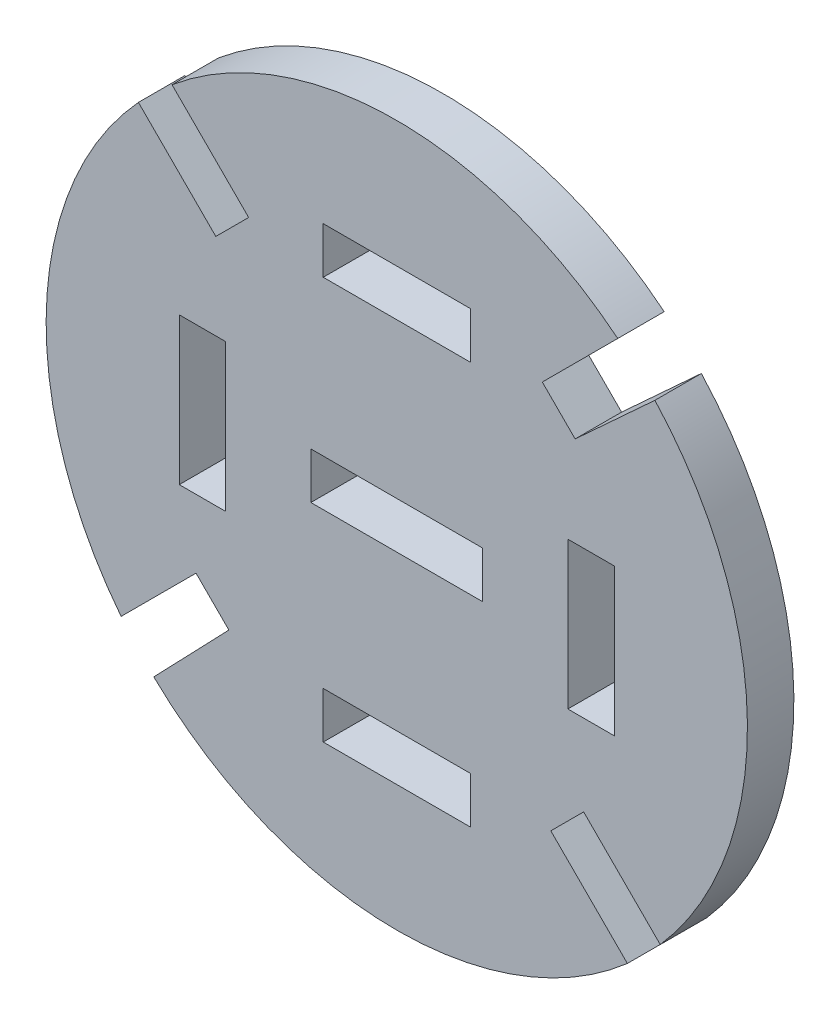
SolidWorks part; units mm, degrees
ref_plane "Alzado" through (0, 0, 0) normal (0, 0, 1) x (1, 0, 0)
ref_plane "Planta" through (0, 0, 0) normal (0, 1, 0) x (1, 0, 0)
ref_plane "Vista lateral" through (0, 0, 0) normal (1, 0, 0) x (0, 0, -1)
sketch "Sketch1" plane through (0, 0, 0) normal (0, 0, 1) x (1, 0, 0)
  line L0 (-11.6893, 10.3145) -> (-16.6886, 15.3139)
  line L1 (-5.55, 1.5) -> (5.55, 1.5)
  line L2 (-5.55, 1.5) -> (-5.55, -1.5)
  line L3 (-5.55, -1.5) -> (5.55, -1.5)
  line L4 (5.55, 1.5) -> (5.55, -1.5)
  line L5 (-5.55, 1.5) -> (5.55, -1.5) construction
  line L6 (-5.55, -1.5) -> (5.55, 1.5) construction
  line L7 (-4.75, -11.5) -> (4.75, -11.5)
  line L8 (-4.75, -11.5) -> (-4.75, -14.5)
  line L9 (-4.75, -14.5) -> (4.75, -14.5)
  line L10 (4.75, -11.5) -> (4.75, -14.5)
  line L11 (-4.75, -11.5) -> (4.75, -14.5) construction
  line L12 (-4.75, -14.5) -> (4.75, -11.5) construction
  line L13 (-4.75, 11.5) -> (4.75, 11.5)
  line L14 (-4.75, 11.5) -> (-4.75, 14.5)
  line L15 (-4.75, 14.5) -> (4.75, 14.5)
  line L16 (4.75, 11.5) -> (4.75, 14.5)
  line L17 (-4.75, 11.5) -> (4.75, 14.5) construction
  line L18 (-4.75, 14.5) -> (4.75, 11.5) construction
  line L19 (-14.05, -4.75) -> (-11.05, -4.75)
  line L20 (-14.05, -4.75) -> (-14.05, 4.75)
  line L21 (-14.05, 4.75) -> (-11.05, 4.75)
  line L22 (-11.05, -4.75) -> (-11.05, 4.75)
  line L23 (-14.05, -4.75) -> (-11.05, 4.75) construction
  line L24 (-14.05, 4.75) -> (-11.05, -4.75) construction
  line L25 (11.05, 4.75) -> (14.05, 4.75)
  line L26 (11.05, 4.75) -> (11.05, -4.75)
  line L27 (11.05, -4.75) -> (14.05, -4.75)
  line L28 (14.05, 4.75) -> (14.05, -4.75)
  line L29 (-11.6893, 10.3145) -> (-9.5679, 12.4359)
  line L30 (-9.5679, 12.4359) -> (-14.5177, 17.3856)
  line L31 (9.9485, -12.1167) -> (14.8951, -17.0633)
  line L32 (9.9485, -12.1167) -> (12.0698, -9.9954)
  line L33 (12.0698, -9.9954) -> (17.0196, -14.9451)
  line L34 (9.3995, 12.7135) -> (11.5208, 10.5922)
  line L35 (9.3995, 12.7135) -> (14.273, 17.587)
  line L36 (11.5208, 10.5922) -> (16.6738, 15.3299)
  line L37 (-10.846, -11.2822) -> (-12.9673, -9.1608)
  line L38 (-12.9673, -9.1608) -> (-17.8057, -13.9992)
  line L39 (-10.846, -11.2822) -> (-15.6972, -16.3285)
  arc A0 (-16.6886, 15.3139) -> (-17.8057, -13.9992) centre (0, 0) ccw
  arc A1 (17.0196, -14.9451) -> (16.6738, 15.3299) centre (0, 0) ccw
  arc A2 (14.273, 17.587) -> (-14.5177, 17.3856) centre (0, 0) ccw
  arc A3 (-15.6972, -16.3285) -> (14.8951, -17.0633) centre (0, 0) ccw
  point P7 (0, -13)
  point P13 (0, 13)
  point P18 (-12.55, 0)
  point P36 (10.4601, 11.6528)
  point P42 (-11.9066, -10.2215)
  dimension "D1" = 45.3
  dimension "D2" = 11.1
  dimension "D3" = 3
  dimension "D4" = 9.5
  dimension "D5" = 3
  dimension "D6" = 10
  dimension "D7" = 10.0319
  dimension "D8" = 9.5
  dimension "D9" = 3
  dimension "D10" = 10
  dimension "D11" = 10.0319
  dimension "D12" = 9.5
  dimension "D13" = 3
  dimension "D14" = 5.5
  dimension "D15" = 6.3885
  dimension "D16" = 9.5
  dimension "D17" = 3
  dimension "D18" = 5.5
  dimension "D19" = 6.3885
  dimension "D20" = 3
  dimension "D21" = 7
  dimension "D22" = 5.5645
  dimension "D23" = 4.8179
  dimension "D24" = 3
  dimension "D25" = 7
  dimension "D26" = 5.1985
  dimension "D27" = 5.2454
  dimension "D28" = 10.6173
  dimension "D29" = 3
  dimension "D30" = 7
  dimension "D31" = 4.6495
  dimension "D32" = 5.8422
  dimension "D33" = 3
  dimension "D34" = 7
  dimension "D35" = 6.096
  dimension "D36" = 4.4108
extrude "Boss-Extrude1" add sketch "Sketch1" along normal blind 3
